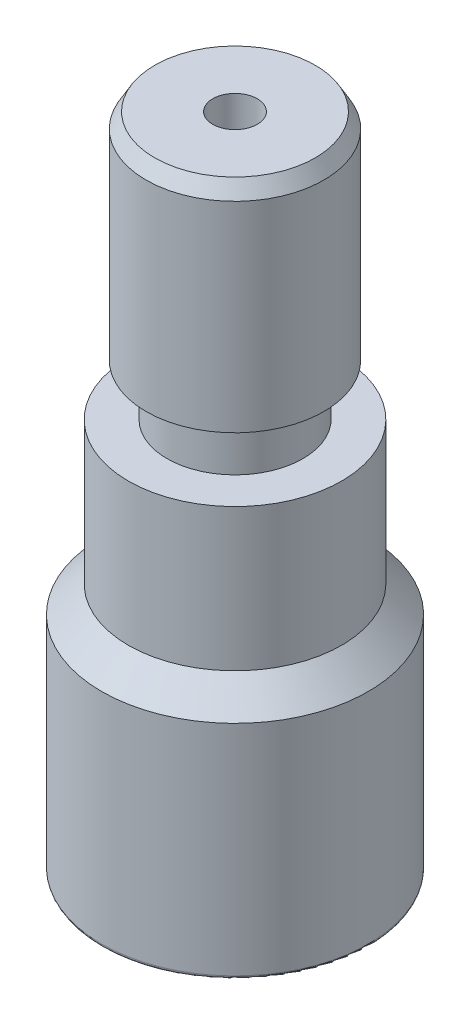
SolidWorks part; units mm, degrees
ref_plane "Front" through (0, 0, 0) normal (0, 0, 1) x (1, 0, 0)
ref_plane "Top" through (0, 0, 0) normal (0, 1, 0) x (1, 0, 0)
ref_plane "Right" through (0, 0, 0) normal (1, 0, 0) x (0, 0, -1)
sketch "Sketch1" plane through (0, 0, 0) normal (0, 1, 0) x (1, 0, 0)
  circle A0 centre (0, 0) radius 4.7625
  dimension "D1" = 9.525
extrude "Extrude1" add sketch "Sketch1" along normal blind 8.89
sketch "Sketch2" plane through (0, 8.89, 0) normal (0, 1, 0) x (-1, 0, 0)
  circle A0 centre (0, 0) radius 3.81
  dimension "D1" = 7.62
extrude "Extrude2" add sketch "Sketch2" along normal blind 5.08
sketch "Sketch3" plane through (0, 13.97, 0) normal (0, 1, 0) x (-1, 0, 0)
  circle A0 centre (0, 0) radius 2.4257
  dimension "D1" = 4.8514
extrude "Extrude3" add sketch "Sketch3" along normal blind 1.524
sketch "Sketch4" plane through (0, 15.494, 0) normal (0, 1, 0) x (-1, 0, 0)
  circle A0 centre (0, 0) radius 3.175
  dimension "D1" = 6.35
extrude "Extrude4" add sketch "Sketch4" along normal blind 8.001
hole_wizard ".25-28 middle" positions "Sketch22" profile "Sketch23" legacy
sketch "Sketch22" plane through (-13.8932, 0, -66.4865) normal (0, -1, 0) x (1, 0, 0)
  point P0 (13.8932, 66.4865)
sketch "Sketch23" plane through (0, 0, 0) normal (1, 0, 0) x (0, 0, -1)
  line L0 (-2.7051, 5.8928) -> (-2.7051, 0.7239) construction
  line L1 (0, 5.8928) -> (2.7051, 5.8928)
  line L2 (0, 0) -> (0, -3.5564) construction
  line L3 (0, 5.8928) -> (0, 0)
  line L4 (2.7051, 5.8928) -> (2.7051, 0.7239)
  line L5 (2.7051, 0.7239) -> (3.429, 0)
  line L6 (3.429, 0) -> (0, 0)
hole_wizard "1/16 (0.0625) Diameter Hole1" positions "Sketch25" profile "Sketch24" hole size "1/16" standard "Ansi Inch"
sketch "Sketch25" plane through (0.0277, 5.8928, 12.6619) normal (0, -1, 0) x (1, 0, 0)
  point P0 (-0.0277, -12.6619)
sketch "Sketch24" plane through (0, 5.8928, 0) normal (1, 0, 0) x (0, 0, -1)
  line L0 (0, 0) -> (0, 17.6022)
  line L1 (0, 17.6022) -> (0.7937, 17.6022)
  line L2 (0.7937, 17.6022) -> (0.7937, 0)
  line L5 (0.7937, 0) -> (0, 0)
  line L11 (0, -6.35) -> (0, 107.95) construction
  dimension "Thru Hole Dia." = 1.5875
  dimension "Thru Hole Depth" = 17.6022
other "Flat Bottom-.25-28<1>"
chamfer "Chamfer1" distance 0.5334 angle 30 2 edges at (0, 15.494, 3.175) (0, 23.495, 3.175)
fillet "Fillet1" radius 0.127 1 edges at (0, 0, 4.7625)
sketch "Sketch26" plane through (0, 0, 0) normal (0, 0, 1) x (1, 0, 0)
  line L0 (3.81, 8.89) -> (4.7625, 7.9375)
  line L1 (4.7625, 0.127) -> (4.7625, 8.89) construction
  line L2 (4.7625, 7.9375) -> (4.7625, 8.89)
  line L3 (4.7625, 8.89) -> (3.81, 8.89)
  line L4 (0, 0) -> (0, -0.9086) construction
  dimension "D1" = 45
revolve "Cut-Revolve1" cut sketch "Sketch26" angle 360 about L4
